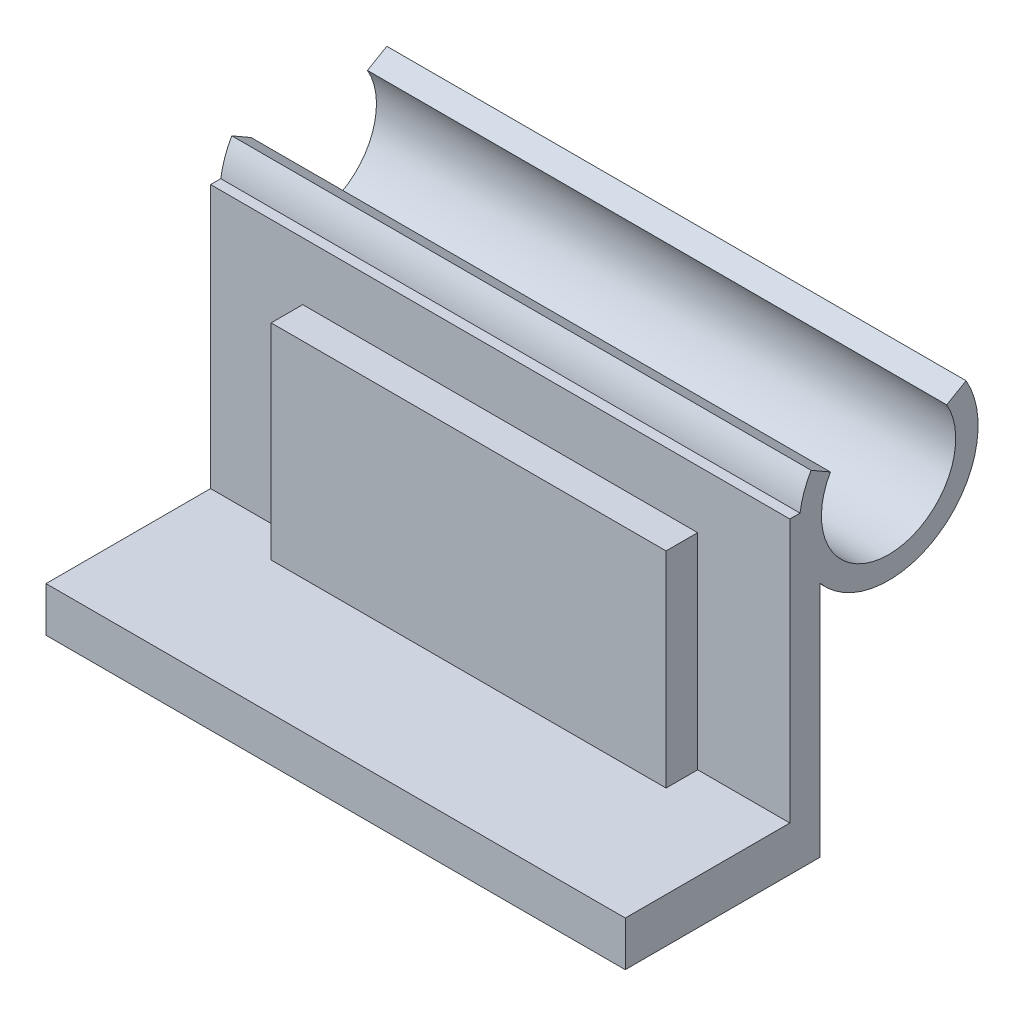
SolidWorks part; units mm, degrees
ref_plane "前视基准面" through (0, 0, 0) normal (0, 0, 1) x (1, 0, 0)
ref_plane "上视基准面" through (0, 0, 0) normal (0, 1, 0) x (1, 0, 0)
ref_plane "右视基准面" through (0, 0, 0) normal (1, 0, 0) x (0, 0, -1)
other "Configuration Table"
sketch "草图1" plane through (0, 0, 0) normal (1, 0, 0) x (0, 0, -1)
  line L0 (-3.75, -11.2) -> (-2.6, -11.2)
  line L1 (-2.6, -11.2) -> (-2.6, 0.5)
  line L2 (-2.6, 0.5) -> (-3.75, 0.5)
  line L3 (-3.75, 0.5) -> (-3.75, -11.2)
extrude "01_PADDLE" add sketch "草图1" against normal mid plane 22
sketch "草图2" plane through (0, 0, 0) normal (1, 0, 0) x (0, 0, -1)
  line L0 (-2.6, -11.2) -> (-2.6, 0.5) construction
  line L1 (-10, -11.2) -> (-2.6, -11.2)
  line L2 (-10, -11.2) -> (-10, -9.5)
  line L3 (-10, -9.5) -> (-2.6, -9.5)
  line L4 (-2.6, -11.2) -> (-2.6, -9.5)
extrude "02_LIP" add sketch "草图2" against normal mid plane 22
sketch "草图3" plane through (0, 0, 0) normal (1, 0, 0) x (0, 0, -1)
  line L0 (-4.95, -9.5) -> (-3.75, -9.5)
  line L1 (-3.75, -9.5) -> (-3.75, -1.7)
  line L2 (-3.75, -1.7) -> (-4.95, -1.7)
  line L3 (-4.95, -1.7) -> (-4.95, -9.5)
extrude "03_PAD" add sketch "草图3" against normal mid plane 15
sketch "草图4" plane through (0, 0, 0) normal (1, 0, 0) x (0, 0, -1)
  line L0 (2.9445, 1.7) -> (2.2084, 1.275)
  line L1 (-2.2084, 1.275) -> (-2.9445, 1.7)
  arc A0 (-2.9445, 1.7) -> (2.9445, 1.7) centre (0, 0) ccw
  arc A1 (2.2084, 1.275) -> (-2.2084, 1.275) centre (0, 0) cw
extrude "04_CLIP" add sketch "草图4" against normal mid plane 22
